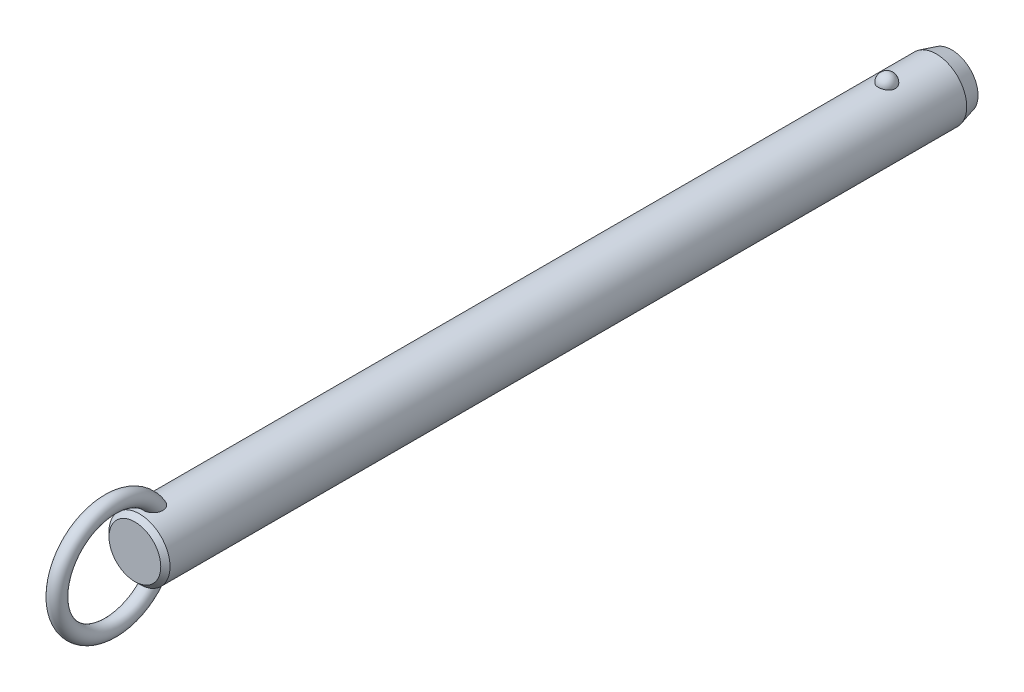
SolidWorks part; units mm, degrees
ref_plane "Front Plane" through (0, 0, 0) normal (0, 0, 1) x (1, 0, 0)
ref_plane "Top Plane" through (0, 0, 0) normal (0, 1, 0) x (1, 0, 0)
ref_plane "Right Plane" through (0, 0, 0) normal (1, 0, 0) x (0, 0, -1)
sketch "Sketch2" plane through (0, 0, 0) normal (0, 0, 1) x (1, 0, 0)
  circle A0 centre (0, 0) radius 7.9
  point P3 (0, 7.9)
  dimension "D1" = 15.8
extrude "Boss-Extrude1" add sketch "Sketch2" along normal blind 182.9
sketch "Sketch3" plane through (0, 0, 0) normal (0, 0, -1) x (-1, 0, 0)
  circle A0 centre (0, 0) radius 7.9
  dimension "D1" = 15.8
extrude "Boss-Extrude2" add sketch "Sketch3" along normal blind 19
chamfer "Chamfer1" distance 4 angle 15 1 edges at (-7.9, 0, -19)
sketch "Sketch12" plane through (0, 0, 0) normal (1, 0, 0) x (0, 0, -1)
  line L0 (-182.9, 7.9) -> (-182.9, -7.9) construction
  point P0 (-182.9, 0)
sketch "Sketch13" plane through (0, 0, 0) normal (1, 0, 0) x (0, 0, -1)
  circle A0 centre (-198.75, 0) radius 15.85
  point P2 (-182.9, 0)
  dimension "D1" = 31.7
sketch "Sketch14" plane through (0, 0, 0) normal (0, 1, 0) x (1, 0, 0)
  circle A0 centre (0, -184.9) radius 2
  point P2 (0, -182.9)
  dimension "D1" = 4
sweep "Sweep1" add profiles "Sketch14" path "Sketch13"
sketch "Sketch15" plane through (0, 0, 182.9) normal (0, 0, 1) x (1, 0, 0)
  circle A0 centre (0, 0) radius 7.9
  dimension "D1" = 15.8
extrude "Boss-Extrude3" add sketch "Sketch15" along normal blind 9.52
chamfer "Chamfer2" distance 1.2 angle 45 1 edges at (7.9, 0, 192.42)
sketch "Sketch18" plane through (0, 0, 0) normal (1, 0, 0) x (0, 0, -1)
  line L0 (15, 7.9) -> (-185.0091, 7.9) construction
  line L1 (2.2, 10.1) -> (2.2, 5.7)
  line L2 (-185.0091, -7.9) -> (15, -7.9) construction
  arc A0 (2.2, 10.1) -> (2.2, 5.7) centre (2.2, 7.9) ccw
  point P4 (0, 7.9)
  dimension "D1" = 18
revolve "Revolve1" add sketch "Sketch18" angle 360 about L1
